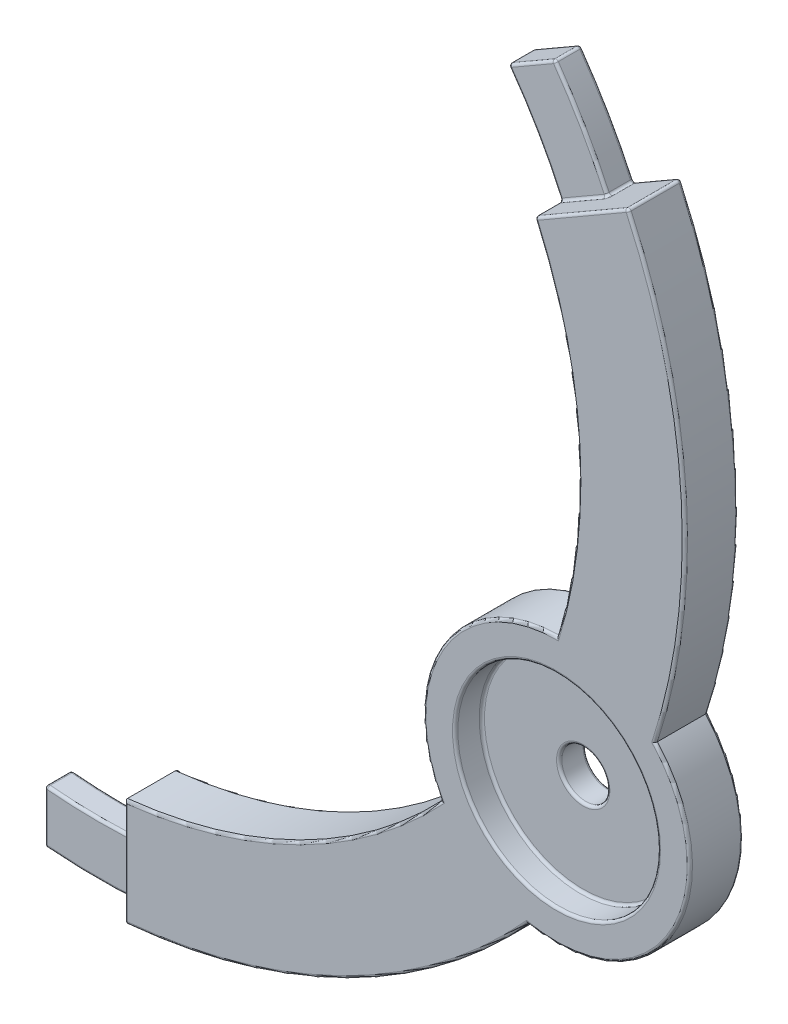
SolidWorks part; units mm, degrees
ref_plane "Спереди" through (0, 0, 0) normal (0, 0, 1) x (1, 0, 0)
ref_plane "Сверху" through (0, 0, 0) normal (0, 1, 0) x (1, 0, 0)
ref_plane "Справа" through (0, 0, 0) normal (1, 0, 0) x (0, 0, -1)
sketch "Эскиз1" plane through (0, 0, 0) normal (0, 0, 1) x (1, 0, 0)
  line L0 (0, 0) -> (99.5929, 57.5) construction
  line L1 (0, 0) -> (0, -115) construction
  line L2 (0, 0) -> (90.9327, -52.5) construction
  line L3 (95.5193, 43.6011) -> (104.2157, 48.6219)
  line L4 (10, -94.4722) -> (10, -104.5227)
  line L5 (-10, -104.5227) -> (-10, -114.5644)
  line L6 (76.8153, 55.8964) -> (85.5193, 60.9216)
  arc A0 (109.3521, -35.5966) -> (104.2157, 48.6219) centre (0, 0) ccw
  circle A1 centre (0, 0) radius 105 construction
  arc A2 (90.9327, -27.5) -> (76.8153, 55.8964) centre (0, 0) ccw
  arc A3 (90.9327, -27.5) -> (69.282, -65) centre (90.9327, -52.5) ccw
  circle A4 centre (0, 0) radius 95 construction
  circle A5 centre (0, 0) radius 115 construction
  arc A6 (85.5036, -76.9034) -> (109.3521, -35.5966) centre (90.9327, -52.5) ccw
  arc A7 (10, -94.4722) -> (69.282, -65) centre (0, 0) ccw
  arc A8 (-10, -114.5644) -> (85.5036, -76.9034) centre (0, 0) ccw
  arc A9 (-10, -104.5227) -> (10, -104.5227) centre (0, 0) ccw
  arc A10 (95.5193, 43.6011) -> (85.5193, 60.9216) centre (0, 0) ccw
  circle A11 centre (90.9327, -52.5) radius 1.75
  dimension "D1" = 230
  dimension "D6" = 50
  dimension "D11" = 3.5
  dimension "D4" = 120
  dimension "D5" = 60
  dimension "D7" = 20
  dimension "D8" = 20
  dimension "D9" = 10
  dimension "D10" = 10
  dimension "D2" = 10
  dimension "D3" = 20
extrude "Бобышка-Вытянуть1" add sketch "Эскиз1" along normal mid plane 10
sketch "Эскиз2" plane through (0, 0, 5) normal (0, 0, 1) x (1, 0, 0)
  line L0 (-10, -104.5227) -> (-10, -114.5644) construction
  line L1 (10, -94.4722) -> (10, -104.5227) construction
  line L2 (76.8153, 55.8964) -> (85.5193, 60.9216) construction
  line L3 (95.5193, 43.6011) -> (104.2157, 48.6219) construction
  line L4 (-10, -104.5227) -> (-10, -114.5644)
  line L5 (10, -104.5227) -> (10, -114.5644)
  line L6 (76.8153, 55.8964) -> (85.5193, 60.9216)
  line L7 (86.8153, 38.5759) -> (95.5193, 43.6011)
  arc A0 (-10, -114.5644) -> (85.5036, -76.9034) centre (0, 0) ccw construction
  arc A1 (-10, -114.5644) -> (10, -114.5644) centre (0, 0) ccw
  circle A3 centre (0, 0) radius 105 construction
  arc A4 (90.9327, -27.5) -> (76.8153, 55.8964) centre (0, 0) ccw construction
  circle A5 centre (90.9327, -52.5) radius 19
  arc A6 (-10, -104.5227) -> (10, -104.5227) centre (0, 0) ccw
  arc A7 (86.8153, 38.5759) -> (76.8153, 55.8964) centre (0, 0) ccw
  arc A8 (95.5193, 43.6011) -> (85.5193, 60.9216) centre (0, 0) ccw
  dimension "D1" = 38
extrude "Вырез-Вытянуть1" cut sketch "Эскиз2" against normal blind 5
sketch "Эскиз3" plane through (0, 0, -5) normal (0, 0, -1) x (-1, 0, 0)
  circle A0 centre (-90.9327, -52.5) radius 4.5
  dimension "D1" = 9
extrude "Вырез-Вытянуть2" cut sketch "Эскиз3" against normal blind 8
fillet "Скругление1" radius 0.5 41 edges at (10, -104.5227, -2.5) (10, -114.5644, 2.5) (82.2724, 47.5, 0) (-10, -114.5644, -2.5) (-10, -104.5227, -2.5) (-10, -109.5436, 0) (0, -105, 0) (10, -109.5436, 0) (0, -115, 0) (76.8153, 55.8964, -2.5) (85.5193, 60.9216, -2.5) (81.1673, 58.409, 0) (104.2157, 48.6219, 0) (86.8153, 38.5759, 2.5) (91.1673, 41.0885, 0) (95.5193, 43.6011, -2.5) (42.2914, -85.0672, -5) (10, -99.4975, -5) (0, -105, -5) (-10, -109.5436, -5) (42.1875, -106.9823, -5) (112.5833, -65, -5) (114.7867, 7.0008, -5) (99.8675, 46.1115, -5) (90.9327, 52.5, -5) (81.1673, 58.409, -5) (93.6674, 15.856, -5) (69.282, -40, -5) (86.4327, -52.5, -5) (109.9327, -52.5, 0) (95.4327, -52.5, 0) (114.7867, 7.0008, 5) (112.5833, -65, 5) (51.3305, -102.9086, 5) (10, -104.5183, 5) (42.2914, -85.0672, 5) (69.282, -40, 5) (94.8161, 5.9082, 5) (95.5155, 43.5989, 5) (109.9327, -52.5, 5) (90.9327, 52.5, 0)
